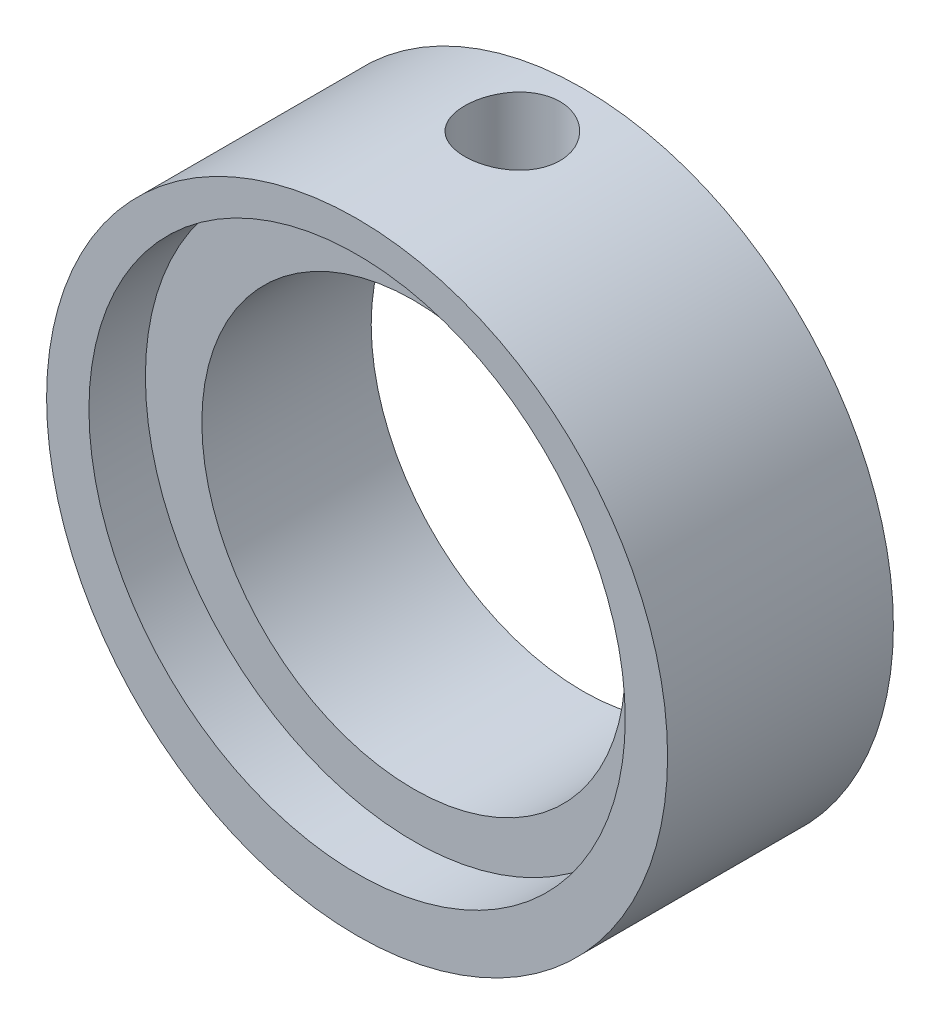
SolidWorks part; units mm, degrees
ref_plane "Plan1" through (0, 0, 0) normal (0, 0, 1) x (1, 0, 0)
ref_plane "Plan2" through (0, 0, 0) normal (0, 1, 0) x (1, 0, 0)
ref_plane "Plan3" through (0, 0, 0) normal (1, 0, 0) x (0, 0, -1)
sketch "Esquisse1" plane through (0, 0, 0) normal (0, 0, 1) x (1, 0, 0)
  circle A0 centre (0, 0) radius 15
  circle A1 centre (0, 0) radius 22
  dimension "D1" = 30
  dimension "D2" = 44
extrude "Base-Extrusion" add sketch "Esquisse1" along normal blind 16
sketch "Esquisse2" plane through (0, 0, 16) normal (0, 0, 1) x (1, 0, 0)
  circle A0 centre (0, 0) radius 15 construction
  circle A1 centre (0, 0) radius 15
  circle A2 centre (0, 0.8) radius 19
  dimension "D1" = 0.8
  dimension "D2" = 38
extrude "Enlèv. mat.-Extru.1" cut sketch "Esquisse2" against normal blind 4
sketch "Esquisse3" plane through (0, 0, 0) normal (0, 1, 0) x (1, 0, 0)
  circle A0 centre (0, -5) radius 3.375
  dimension "D2" = 6.75
  dimension "D1" = 5
extrude "Enlèv. mat.-Extru.2" cut sketch "Esquisse3" along normal through all
